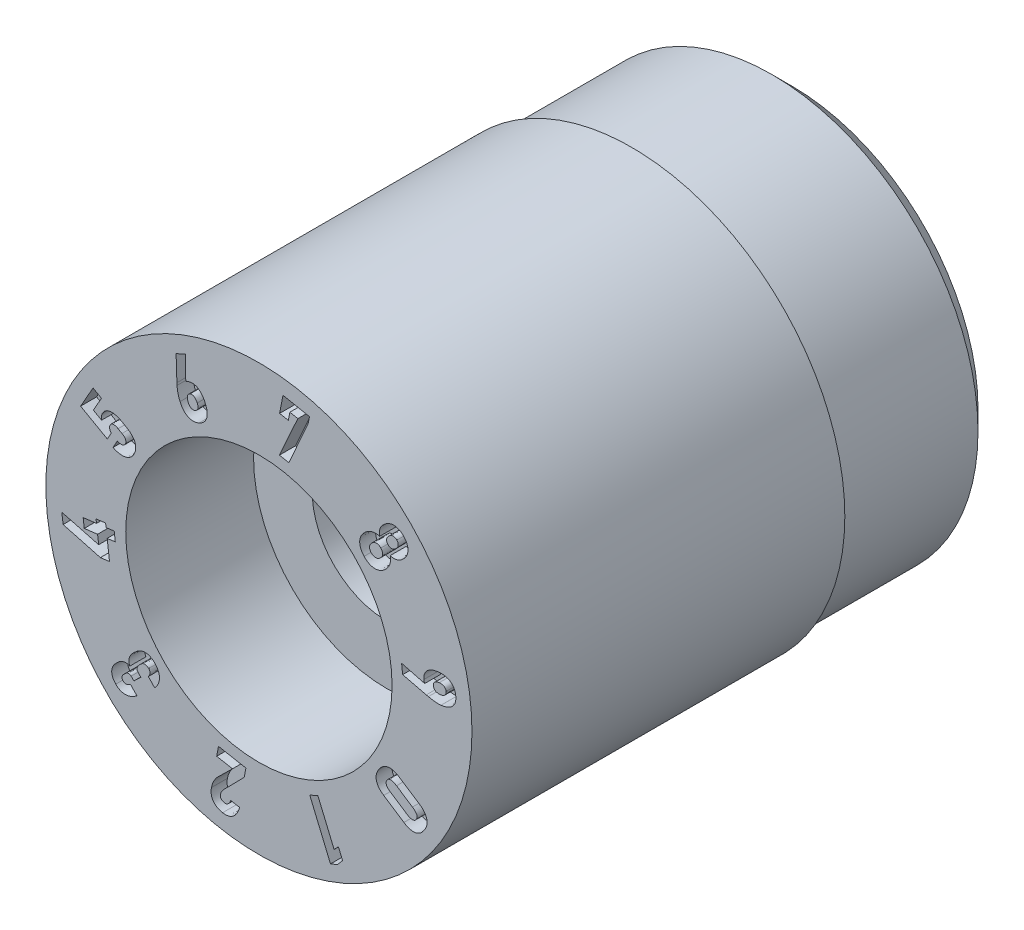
SolidWorks part; units mm, degrees
ref_plane "Front Plane" through (0, 0, 0) normal (0, 0, 1) x (1, 0, 0)
ref_plane "Top Plane" through (0, 0, 0) normal (0, 1, 0) x (1, 0, 0)
ref_plane "Right Plane" through (0, 0, 0) normal (1, 0, 0) x (0, 0, -1)
sketch "Sketch1" plane through (0, 0, 0) normal (1, 0, 0) x (0, 0, -1)
  line L2 (0, 2) -> (0, 1.25)
  line L3 (4.75, 2) -> (0, 2)
  line L4 (-3.7979, 0) -> (49996.2021, 0) construction
  line L8 (5, 0.7) -> (1.2, 0.7)
  line L9 (1.2, 1.25) -> (1.2, 0.7)
  line L10 (1.2, 1.25) -> (0, 1.25)
  line L12 (5, 0.7) -> (5, 1.75)
  line L16 (5, 1.75) -> (4.75, 2)
  dimension "D1" = 5
  dimension "D2" = 45
  dimension "D3" = 0.25
  dimension "D4" = 4
  dimension "D5" = 2.5
  dimension "D6" = 1.2
  dimension "D7" = 1.4
revolve "Revolve1" add sketch "Sketch1" angle 360 about L4
sketch "Sketch5" plane through (0, 0, 0) normal (1, 0, 0) x (0, 0, -1)
  line L0 (0, 0) -> (50000, 0) construction
  line L1 (0, 2) -> (0, -2) construction
  line L2 (3.5, 1.935) -> (5, 1.935)
  line L3 (3.5, 1.935) -> (3.5, 2.935)
  line L4 (3.5, 2.935) -> (5, 2.935)
  line L5 (5, 1.935) -> (5, 2.935)
  line L6 (5, -1.75) -> (5, 1.75) construction
  line L7 (4.75, 2) -> (0, 2) construction
  dimension "D1" = 3.5
  dimension "D2" = 0.065
  dimension "D3" = 1
revolve "Cut-Revolve1" cut sketch "Sketch5" angle 360 about L0
sketch "Sketch7" plane through (0, 0, 0) normal (0, 0, 1) x (1, 0, 0)
  line L0 (-1.5142, -0.1522) -> (-1.6396, -0.1678)
  line L1 (1.6806, 0.3271) -> (1.681, 0.3271)
  line L2 (1.7094, 0.0695) -> (1.7091, 0.0695)
  line L3 (1.5709, 0.0846) -> (1.3494, 0.1382)
  line L4 (1.3494, 0.1382) -> (1.3391, 0.2259)
  line L5 (1.3391, 0.2259) -> (1.5564, 0.1696)
  line L6 (1.7038, 0.1528) -> (1.7042, 0.1528)
  line L7 (1.693, 0.2446) -> (1.6927, 0.2446)
  line L8 (0.9938, 1.1161) -> (0.9999, 1.1218)
  line L9 (1.1661, 1.2638) -> (1.1757, 1.2727)
  line L10 (1.3542, 1.0805) -> (1.3446, 1.0717)
  line L11 (1.1909, 0.9164) -> (1.1848, 0.9107)
  line L12 (1.1381, 0.9811) -> (1.1417, 0.9844)
  line L13 (1.0639, 1.0675) -> (1.0601, 1.0639)
  line L14 (1.2851, 1.1303) -> (1.2886, 1.1334)
  line L15 (1.2234, 1.2031) -> (1.2196, 1.1997)
  line L16 (0.4628, 1.7375) -> (0.2818, 1.3271)
  line L17 (0.2818, 1.3271) -> (0.1928, 1.3444)
  line L18 (0.1928, 1.3444) -> (0.3656, 1.7276)
  line L19 (0.3656, 1.7276) -> (0.2907, 1.7422)
  line L20 (0.2907, 1.7422) -> (0.2763, 1.6682)
  line L21 (0.2763, 1.6682) -> (0.1943, 1.6842)
  line L22 (0.1943, 1.6842) -> (0.226, 1.8472)
  line L23 (0.226, 1.8472) -> (0.4747, 1.7988)
  line L24 (0.4747, 1.7988) -> (0.4628, 1.7375)
  line L25 (-0.7404, 1.3129) -> (-0.7405, 1.3132)
  line L26 (-0.7699, 1.4517) -> (-0.7771, 1.6843)
  line L27 (-0.7771, 1.6843) -> (-0.6913, 1.7235)
  line L28 (-0.6913, 1.7235) -> (-0.6862, 1.5014)
  line L29 (-1.4244, -0.141) -> (-1.4022, -0.3185)
  line L30 (-0.5054, 1.4223) -> (-0.5053, 1.422)
  line L31 (-0.5788, 1.382) -> (-0.579, 1.3823)
  line L32 (-0.6627, 1.3438) -> (-0.6626, 1.3435)
  line L33 (-1.369, 0.6256) -> (-1.3693, 0.6258)
  line L34 (-1.3693, 0.6258) -> (-1.3283, 0.6983)
  line L35 (-1.3283, 0.6983) -> (-1.328, 0.6981)
  line L36 (-1.2854, 0.781) -> (-1.3219, 0.8017)
  line L37 (-1.3852, 0.7353) -> (-1.4234, 0.6676)
  line L38 (-1.4234, 0.6676) -> (-1.6736, 0.8092)
  line L39 (-1.6736, 0.8092) -> (-1.5569, 1.0156)
  line L40 (-1.5569, 1.0156) -> (-1.4779, 0.971)
  line L41 (-1.4779, 0.971) -> (-1.5537, 0.837)
  line L42 (-1.5537, 0.837) -> (-1.4768, 0.7935)
  line L43 (-1.2809, 0.8742) -> (-1.2445, 0.8535)
  line L44 (-1.488, -0.3292) -> (-1.8381, -0.2352)
  line L45 (-1.8381, -0.2352) -> (-1.8498, -0.1414)
  line L46 (-1.8498, -0.1414) -> (-1.5042, -0.2323)
  line L47 (-1.5042, -0.2323) -> (-1.5142, -0.1522)
  line L48 (-1.5289, -0.0349) -> (-1.439, -0.0236)
  line L49 (-1.439, -0.0236) -> (-1.4347, -0.0581)
  line L50 (-1.4022, -0.3185) -> (-1.488, -0.3292)
  line L51 (-1.6396, -0.1678) -> (-1.6499, -0.0849)
  line L52 (-1.6499, -0.0849) -> (-1.5246, -0.0693)
  line L53 (-1.3583, -0.0486) -> (-1.348, -0.1316)
  line L54 (-1.348, -0.1316) -> (-1.4244, -0.141)
  line L55 (-0.9787, -1.1329) -> (-1.0379, -1.0708)
  line L56 (-1.1102, -1.0071) -> (-1.1187, -1.0151)
  line L57 (-1.1338, -1.0853) -> (-1.1081, -1.1123)
  line L58 (-1.1081, -1.1123) -> (-1.1737, -1.1748)
  line L59 (-1.1737, -1.1748) -> (-1.1994, -1.1478)
  line L60 (-1.2594, -1.1593) -> (-1.2656, -1.1652)
  line L61 (-1.2042, -1.2193) -> (-1.1451, -1.2813)
  line L62 (-1.3341, -1.1072) -> (-1.3232, -1.0968)
  line L63 (-1.1748, -0.9456) -> (-1.1639, -0.9352)
  line L64 (-0.1377, -1.44) -> (-0.3282, -1.6337)
  line L65 (-0.3606, -1.6897) -> (-0.3607, -1.6903)
  line L66 (-0.2657, -1.6911) -> (-0.2657, -1.6908)
  line L67 (-0.2657, -1.6908) -> (-0.1815, -1.7064)
  line L68 (-0.1815, -1.7064) -> (-0.1815, -1.7067)
  line L69 (-0.4456, -1.6773) -> (-0.4454, -1.6769)
  line L70 (-0.3829, -1.5584) -> (-0.2475, -1.4257)
  line L71 (-0.2475, -1.4257) -> (-0.3962, -1.3981)
  line L72 (-0.3962, -1.3981) -> (-0.3797, -1.309)
  line L73 (-0.3797, -1.309) -> (-0.1222, -1.3567)
  line L74 (-0.1222, -1.3567) -> (-0.1377, -1.44)
  line L75 (0.4773, -1.2764) -> (0.5541, -1.2441)
  line L76 (0.5541, -1.2441) -> (0.7056, -1.6046)
  line L77 (0.7056, -1.6046) -> (0.7462, -1.5625)
  line L78 (0.7462, -1.5625) -> (0.7851, -1.6552)
  line L79 (0.7851, -1.6552) -> (0.7375, -1.7119)
  line L80 (0.7375, -1.7119) -> (0.6719, -1.7395)
  line L81 (0.6719, -1.7395) -> (0.4773, -1.2764)
  line L82 (1.3177, -0.7109) -> (1.5071, -0.8358)
  line L83 (1.361, -1.0574) -> (1.1716, -0.9326)
  line L84 (1.2376, -0.876) -> (1.387, -0.9744)
  line L85 (1.4411, -0.8924) -> (1.2917, -0.794)
  line L86 (-1.4347, -0.0581) -> (-1.3583, -0.0486)
  line L87 (-1.5246, -0.0693) -> (-1.5289, -0.0349)
  spline S0 degree 3 poles (1.5564, 0.1696) (1.5563, 0.17) (1.5548, 0.1731) (1.5513, 0.1824) (1.5491, 0.1918) (1.5485, 0.1984) knots 0.575687 0.575687 0.575687 0.575687 0.592674 0.720868 1 1 1 1
  spline S1 degree 3 poles (1.5485, 0.1984) (1.5473, 0.2089) (1.5476, 0.2249) (1.553, 0.2451) (1.5594, 0.2593) (1.568, 0.2725) (1.5788, 0.2844) (1.5915, 0.2951) (1.6062, 0.3046) (1.6226, 0.3127) (1.6472, 0.3216) (1.667, 0.3254) (1.6806, 0.3271) knots 0 0 0 0 0.154342 0.228386 0.302989 0.3789 0.455726 0.53585 0.619968 0.708622 0.800971 1 1 1 1
  spline S2 degree 3 poles (1.681, 0.3271) (1.6958, 0.3289) (1.7177, 0.3299) (1.7458, 0.3267) (1.7646, 0.322) (1.7817, 0.3156) (1.7971, 0.3071) (1.8106, 0.2964) (1.8222, 0.2839) (1.8318, 0.2695) (1.842, 0.2472) (1.8463, 0.2288) (1.8477, 0.216) knots 0 0 0 0 0.197916 0.287724 0.372159 0.45229 0.528708 0.60302 0.677527 0.753081 0.830657 1 1 1 1
  spline S3 degree 3 poles (1.8477, 0.216) (1.8493, 0.2034) (1.8493, 0.1846) (1.8444, 0.1606) (1.8382, 0.1444) (1.8297, 0.1295) (1.8188, 0.116) (1.8056, 0.1042) (1.7903, 0.0938) (1.7729, 0.0851) (1.7461, 0.0754) (1.7244, 0.0712) (1.7094, 0.0695) knots 0 0 0 0 0.167209 0.244725 0.320117 0.394646 0.46919 0.546248 0.626545 0.711531 0.801283 1 1 1 1
  spline S4 degree 3 poles (1.7091, 0.0695) (1.7005, 0.0684) (1.6871, 0.0679) (1.6689, 0.0682) (1.6544, 0.0694) (1.6393, 0.0712) (1.6179, 0.0744) (1.6015, 0.0777) (1.5904, 0.08) knots 0 0 0 0 0.217526 0.334184 0.455433 0.582256 0.714812 1 1 1 1
  spline S5 degree 3 poles (1.5904, 0.08) (1.5871, 0.0807) (1.5805, 0.082) (1.5741, 0.0838) (1.5709, 0.0846) knots 0 0 0 0 0.505693 1 1 1 1
  spline S6 degree 3 poles (1.6377, 0.1914) (1.6386, 0.1849) (1.6413, 0.1751) (1.6497, 0.1651) (1.6575, 0.1591) (1.6671, 0.155) (1.6826, 0.1514) (1.6952, 0.1519) (1.7038, 0.1528) knots 0 0 0 0 0.230169 0.338418 0.449646 0.568574 0.698316 1 1 1 1
  spline S7 degree 3 poles (1.7042, 0.1528) (1.7125, 0.1538) (1.7243, 0.1565) (1.7381, 0.1633) (1.746, 0.1696) (1.7521, 0.177) (1.7573, 0.1889) (1.758, 0.1989) (1.7571, 0.2054) knots 0 0 0 0 0.298042 0.425532 0.543246 0.654924 0.764691 1 1 1 1
  spline S8 degree 3 poles (1.7571, 0.2054) (1.7563, 0.2121) (1.7536, 0.2219) (1.7455, 0.2322) (1.7377, 0.238) (1.7285, 0.2423) (1.7135, 0.2458) (1.7013, 0.2456) (1.693, 0.2446) knots 0 0 0 0 0.237917 0.346299 0.458254 0.576208 0.703244 1 1 1 1
  spline S9 degree 3 poles (1.6927, 0.2446) (1.6841, 0.2435) (1.6718, 0.241) (1.6576, 0.234) (1.6494, 0.2276) (1.6431, 0.2201) (1.6374, 0.2082) (1.6371, 0.198) (1.6377, 0.1914) knots 0 0 0 0 0.301058 0.429121 0.547462 0.658814 0.765817 1 1 1 1
  spline S10 degree 3 poles (0.9877, 0.919) (0.9788, 0.9288) (0.9667, 0.9442) (0.9555, 0.9673) (0.9496, 0.9845) (0.9463, 1.002) (0.9458, 1.0195) (0.9474, 1.0369) (0.9519, 1.054) (0.9588, 1.0707) (0.9713, 1.0927) (0.9843, 1.1072) (0.9938, 1.1161) knots 0 0 0 0 0.178865 0.262561 0.344368 0.424163 0.502187 0.579638 0.65918 0.740439 0.823444 1 1 1 1
  spline S11 degree 3 poles (0.9999, 1.1218) (1.0089, 1.1302) (1.0238, 1.141) (1.0462, 1.1511) (1.0637, 1.1567) (1.0817, 1.16) (1.1052, 1.1611) (1.1226, 1.1583) (1.1335, 1.1546) knots 0 0 0 0 0.2551 0.381157 0.510317 0.637625 0.760202 1 1 1 1
  spline S12 degree 3 poles (1.1335, 1.1546) (1.1311, 1.1641) (1.1294, 1.1789) (1.1314, 1.1986) (1.1347, 1.2134) (1.14, 1.2277) (1.1492, 1.2455) (1.1588, 1.2571) (1.1661, 1.2638) knots 0 0 0 0 0.246185 0.369649 0.497384 0.625631 0.75083 1 1 1 1
  spline S13 degree 3 poles (1.1757, 1.2727) (1.1848, 1.281) (1.1992, 1.2922) (1.2208, 1.3025) (1.2369, 1.3079) (1.2534, 1.3109) (1.2698, 1.3115) (1.2862, 1.3098) (1.3024, 1.3055) (1.3182, 1.2991) (1.339, 1.2872) (1.3526, 1.2749) (1.361, 1.2659) knots 0 0 0 0 0.177128 0.2605 0.341667 0.421494 0.499624 0.577652 0.657305 0.738948 0.822231 1 1 1 1
  spline S14 degree 3 poles (1.361, 1.2659) (1.3694, 1.2568) (1.3806, 1.2423) (1.391, 1.2207) (1.3963, 1.2045) (1.3993, 1.188) (1.4, 1.1716) (1.3981, 1.1552) (1.3939, 1.139) (1.3875, 1.1232) (1.3753, 1.1027) (1.3634, 1.0889) (1.3542, 1.0805) knots 0 0 0 0 0.177766 0.261115 0.342723 0.422528 0.500149 0.578694 0.658324 0.739494 0.822575 1 1 1 1
  spline S15 degree 3 poles (1.3446, 1.0717) (1.3373, 1.0649) (1.3249, 1.056) (1.3063, 1.0481) (1.2916, 1.0441) (1.2766, 1.0419) (1.2567, 1.0418) (1.242, 1.0446) (1.2328, 1.0478) knots 0 0 0 0 0.25101 0.37578 0.503509 0.630444 0.754426 1 1 1 1
  spline S16 degree 3 poles (1.2328, 1.0478) (1.2355, 1.0365) (1.2373, 1.0189) (1.2345, 0.9953) (1.23, 0.9776) (1.2234, 0.9604) (1.2117, 0.9389) (1.1999, 0.9246) (1.1909, 0.9164) knots 0 0 0 0 0.241695 0.364575 0.491897 0.62057 0.745921 1 1 1 1
  spline S17 degree 3 poles (1.1848, 0.9107) (1.1752, 0.9017) (1.1597, 0.8901) (1.137, 0.879) (1.1198, 0.8733) (1.1023, 0.8702) (1.0848, 0.8697) (1.0674, 0.8716) (1.0502, 0.8763) (1.0334, 0.8834) (1.0114, 0.8963) (0.9967, 0.9094) (0.9877, 0.919) knots 0 0 0 0 0.176635 0.259674 0.340714 0.420304 0.497814 0.576233 0.655966 0.737533 0.820955 1 1 1 1
  spline S18 degree 3 poles (1.0541, 0.9808) (1.0577, 0.9769) (1.0637, 0.9718) (1.0728, 0.9668) (1.0798, 0.9641) (1.0871, 0.9626) (1.0946, 0.9621) (1.1021, 0.9626) (1.1097, 0.9642) (1.1172, 0.9669) (1.1272, 0.9719) (1.1338, 0.9772) (1.1381, 0.9811) knots 0 0 0 0 0.168215 0.248473 0.328119 0.406502 0.485537 0.564573 0.646351 0.730053 0.817003 1 1 1 1
  spline S19 degree 3 poles (1.1417, 0.9844) (1.1455, 0.9881) (1.1508, 0.9939) (1.1558, 1.0028) (1.1585, 1.0096) (1.1603, 1.0166) (1.161, 1.0237) (1.1607, 1.0308) (1.1594, 1.0379) (1.1572, 1.0449) (1.1526, 1.0542) (1.1479, 1.0605) (1.1442, 1.0644) knots 0 0 0 0 0.176883 0.260022 0.340338 0.419699 0.498223 0.57642 0.655715 0.737714 0.82076 1 1 1 1
  spline S20 degree 3 poles (1.1442, 1.0644) (1.1405, 1.0683) (1.1347, 1.0737) (1.1257, 1.0787) (1.1188, 1.0815) (1.1119, 1.0834) (1.1048, 1.084) (1.0976, 1.0839) (1.0904, 1.0825) (1.0834, 1.0803) (1.0741, 1.0759) (1.0679, 1.071) (1.0639, 1.0675) knots 0 0 0 0 0.177833 0.260675 0.34217 0.421528 0.499771 0.578775 0.659098 0.740803 0.823067 1 1 1 1
  spline S21 degree 3 poles (1.0601, 1.0639) (1.0558, 1.0601) (1.0503, 1.0537) (1.0445, 1.0442) (1.0414, 1.037) (1.0392, 1.0296) (1.0382, 1.0222) (1.0381, 1.0148) (1.0393, 1.0075) (1.0414, 1.0003) (1.046, 0.9911) (1.0503, 0.9845) (1.0541, 0.9808) knots 0 0 0 0 0.183567 0.269825 0.353983 0.435456 0.514421 0.591549 0.670671 0.75006 0.830718 1 1 1 1
  spline S22 degree 3 poles (1.2111, 1.1266) (1.2142, 1.1233) (1.2193, 1.1189) (1.2272, 1.1148) (1.2332, 1.1128) (1.2396, 1.1116) (1.2461, 1.1116) (1.2527, 1.1124) (1.2594, 1.1142) (1.2661, 1.1168) (1.2751, 1.1218) (1.2812, 1.1266) (1.2851, 1.1303) knots 0 0 0 0 0.163469 0.240494 0.316585 0.393494 0.470452 0.550442 0.632503 0.719145 0.80824 1 1 1 1
  spline S23 degree 3 poles (1.2886, 1.1334) (1.2923, 1.1368) (1.2971, 1.1422) (1.3022, 1.1503) (1.3049, 1.1564) (1.3069, 1.1626) (1.3078, 1.1689) (1.3079, 1.1752) (1.3071, 1.1814) (1.3054, 1.1875) (1.3016, 1.1955) (1.2978, 1.201) (1.2946, 1.2042) knots 0 0 0 0 0.187062 0.272248 0.356042 0.43741 0.515938 0.592362 0.670714 0.750135 0.829923 1 1 1 1
  spline S24 degree 3 poles (1.2946, 1.2042) (1.2915, 1.2076) (1.2865, 1.212) (1.2787, 1.2161) (1.2727, 1.2182) (1.2666, 1.2196) (1.2604, 1.2198) (1.254, 1.2194) (1.2477, 1.2178) (1.2413, 1.2155) (1.2328, 1.211) (1.227, 1.2065) (1.2234, 1.2031) knots 0 0 0 0 0.169927 0.248952 0.327351 0.405378 0.483001 0.560789 0.643098 0.727145 0.814694 1 1 1 1
  spline S25 degree 3 poles (1.2196, 1.1997) (1.2158, 1.1961) (1.2106, 1.1904) (1.2052, 1.182) (1.2021, 1.1755) (1.2, 1.169) (1.1985, 1.1625) (1.1983, 1.1561) (1.1989, 1.1497) (1.2005, 1.1435) (1.204, 1.1353) (1.208, 1.1299) (1.2111, 1.1266) knots 0 0 0 0 0.188717 0.277937 0.363923 0.446926 0.526196 0.603917 0.680676 0.758388 0.836217 1 1 1 1
  spline S26 degree 3 poles (-0.5602, 1.2295) (-0.5718, 1.2242) (-0.5896, 1.2183) (-0.6138, 1.2155) (-0.6311, 1.2162) (-0.6478, 1.2194) (-0.6637, 1.2255) (-0.6789, 1.234) (-0.6933, 1.245) (-0.7068, 1.2585) (-0.7238, 1.2806) (-0.7342, 1.2995) (-0.7404, 1.3129) knots 0 0 0 0 0.169425 0.247701 0.32376 0.398456 0.473317 0.549457 0.629523 0.713965 0.802912 1 1 1 1
  spline S27 degree 3 poles (-0.7405, 1.3132) (-0.7443, 1.3217) (-0.7496, 1.3349) (-0.7551, 1.3533) (-0.7632, 1.3832) (-0.7666, 1.4091) (-0.7686, 1.43) knots 0 0 0 0 0.231657 0.352644 0.477573 1 1 1 1
  spline S28 degree 3 poles (-0.7686, 1.43) (-0.7689, 1.4336) (-0.7697, 1.4409) (-0.7697, 1.4481) (-0.7699, 1.4517) knots 0 0 0 0 0.503063 1 1 1 1
  spline S29 degree 3 poles (-0.6862, 1.5014) (-0.6819, 1.5047) (-0.6772, 1.5075) (-0.6722, 1.5098) knots 0.764686 0.764686 0.764686 0.764686 1 1 1 1
  spline S30 degree 3 poles (-0.6722, 1.5098) (-0.6619, 1.5146) (-0.6457, 1.5197) (-0.6238, 1.5215) (-0.6081, 1.5201) (-0.5928, 1.5163) (-0.5781, 1.51) (-0.564, 1.5011) (-0.5507, 1.4897) (-0.5378, 1.4762) (-0.5216, 1.4542) (-0.5114, 1.4356) (-0.5054, 1.4223) knots 0 0 0 0 0.160459 0.235287 0.308247 0.381672 0.456025 0.533385 0.615195 0.702139 0.794729 1 1 1 1
  spline S31 degree 3 poles (-0.5053, 1.422) (-0.4992, 1.4084) (-0.4914, 1.388) (-0.4861, 1.3603) (-0.4846, 1.3411) (-0.4856, 1.3228) (-0.489, 1.3056) (-0.495, 1.2895) (-0.5034, 1.2746) (-0.5142, 1.2611) (-0.5323, 1.2444) (-0.5486, 1.2348) (-0.5602, 1.2295) knots 0 0 0 0 0.197488 0.28655 0.371144 0.451142 0.527616 0.602299 0.677047 0.752733 0.830523 1 1 1 1
  spline S32 degree 3 poles (-0.5978, 1.3119) (-0.5917, 1.3147) (-0.5834, 1.3202) (-0.5756, 1.3307) (-0.5723, 1.3395) (-0.5707, 1.3491) (-0.5716, 1.3638) (-0.5755, 1.3748) (-0.5788, 1.382) knots 0 0 0 0 0.244452 0.355993 0.467582 0.584057 0.709091 1 1 1 1
  spline S33 degree 3 poles (-0.579, 1.3823) (-0.5827, 1.3907) (-0.5892, 1.4021) (-0.6005, 1.4144) (-0.6092, 1.4207) (-0.6185, 1.4248) (-0.6317, 1.4268) (-0.6417, 1.4244) (-0.6477, 1.4215) knots 0 0 0 0 0.307386 0.437241 0.55652 0.66685 0.772945 1 1 1 1
  spline S34 degree 3 poles (-0.6477, 1.4215) (-0.6538, 1.4188) (-0.6622, 1.413) (-0.6689, 1.4015) (-0.6719, 1.3918) (-0.6728, 1.381) (-0.6708, 1.3645) (-0.6665, 1.3521) (-0.6627, 1.3438) knots 0 0 0 0 0.223938 0.330652 0.44208 0.562623 0.69374 1 1 1 1
  spline S35 degree 3 poles (-0.6626, 1.3435) (-0.6593, 1.3363) (-0.6536, 1.3262) (-0.6431, 1.316) (-0.6349, 1.3107) (-0.6261, 1.3077) (-0.6133, 1.3066) (-0.6038, 1.3091) (-0.5978, 1.3119) knots 0 0 0 0 0.292476 0.418585 0.535162 0.647147 0.757326 1 1 1 1
  spline S36 degree 3 poles (-1.1751, 0.6646) (-1.1807, 0.6547) (-1.1908, 0.641) (-1.2079, 0.6264) (-1.2219, 0.6173) (-1.2372, 0.6105) (-1.2536, 0.6057) (-1.2711, 0.6034) (-1.2896, 0.603) (-1.3088, 0.6051) (-1.3359, 0.6113) (-1.3559, 0.6192) (-1.369, 0.6256) knots 0 0 0 0 0.154778 0.229982 0.305397 0.381063 0.45817 0.537687 0.62153 0.709094 0.800675 1 1 1 1
  spline S37 degree 3 poles (-1.328, 0.6981) (-1.3204, 0.6947) (-1.309, 0.6906) (-1.2937, 0.6889) (-1.2835, 0.6896) (-1.2742, 0.6921) (-1.2632, 0.698) (-1.2571, 0.7053) (-1.254, 0.7107) knots 0 0 0 0 0.300685 0.431189 0.552727 0.667114 0.7756 1 1 1 1
  spline S38 degree 3 poles (-1.254, 0.7107) (-1.2508, 0.7165) (-1.2473, 0.726) (-1.2483, 0.739) (-1.2512, 0.7484) (-1.2566, 0.7574) (-1.2671, 0.7696) (-1.2778, 0.7766) (-1.2854, 0.781) knots 0 0 0 0 0.229073 0.335997 0.446506 0.565755 0.695468 1 1 1 1
  spline S39 degree 3 poles (-1.3219, 0.8017) (-1.3295, 0.8061) (-1.3409, 0.8114) (-1.3565, 0.8149) (-1.3666, 0.8151) (-1.3758, 0.8135) (-1.3867, 0.8083) (-1.3929, 0.8016) (-1.3957, 0.7963) knots 0 0 0 0 0.31782 0.450521 0.571898 0.681761 0.784843 1 1 1 1
  spline S40 degree 3 poles (-1.3957, 0.7963) (-1.3984, 0.7914) (-1.4016, 0.7836) (-1.4025, 0.7727) (-1.4019, 0.7646) (-1.3999, 0.7567) (-1.395, 0.7463) (-1.3894, 0.7395) (-1.3852, 0.7353) knots 0 0 0 0 0.250775 0.369742 0.488582 0.609434 0.733145 1 1 1 1
  spline S41 degree 3 poles (-1.4768, 0.7935) (-1.4783, 0.798) (-1.4795, 0.8054) (-1.4795, 0.8156) (-1.4785, 0.8238) (-1.4768, 0.8321) (-1.4737, 0.8427) (-1.4705, 0.8503) (-1.4677, 0.8549) knots 0 0 0 0 0.226423 0.347979 0.479919 0.615426 0.745491 1 1 1 1
  spline S42 degree 3 poles (-1.4677, 0.8549) (-1.4626, 0.8643) (-1.4529, 0.877) (-1.4367, 0.8902) (-1.4234, 0.8976) (-1.4089, 0.9028) (-1.3932, 0.9054) (-1.3765, 0.9059) (-1.3589, 0.9041) (-1.3404, 0.8999) (-1.3137, 0.8913) (-1.2941, 0.8815) (-1.2809, 0.8742) knots 0 0 0 0 0.152166 0.223347 0.294447 0.366447 0.440747 0.518751 0.601934 0.691147 0.786728 1 1 1 1
  spline S43 degree 3 poles (-1.2445, 0.8535) (-1.2314, 0.846) (-1.213, 0.8339) (-1.1923, 0.8146) (-1.1797, 0.7998) (-1.1697, 0.7843) (-1.1624, 0.7683) (-1.1576, 0.7518) (-1.1557, 0.7347) (-1.1564, 0.7173) (-1.1611, 0.6932) (-1.1688, 0.6758) (-1.1751, 0.6646) knots 0 0 0 0 0.198061 0.287434 0.372024 0.452139 0.52865 0.602966 0.677551 0.753056 0.830797 1 1 1 1
  spline S44 degree 3 poles (-0.975, -0.9341) (-0.9664, -0.9434) (-0.9546, -0.9582) (-0.9434, -0.9802) (-0.9375, -0.997) (-0.9339, -1.0141) (-0.9325, -1.0315) (-0.9341, -1.049) (-0.9379, -1.0666) (-0.9443, -1.084) (-0.9565, -1.1072) (-0.9691, -1.1231) (-0.9787, -1.1329) knots 0 0 0 0 0.17138 0.25246 0.3321 0.410218 0.487785 0.565878 0.646425 0.72927 0.815073 1 1 1 1
  spline S45 degree 3 poles (-1.0379, -1.0708) (-1.0319, -1.0638) (-1.0261, -1.0537) (-1.0229, -1.0409) (-1.0223, -1.035) (-1.0225, -1.0293) (-1.0234, -1.0238) (-1.025, -1.0184) (-1.0284, -1.0113) (-1.0321, -1.0066) (-1.0348, -1.0037) knots 0 0 0 0 0.373227 0.455142 0.533831 0.610763 0.685923 0.760617 0.838001 1 1 1 1
  spline S46 degree 3 poles (-1.0348, -1.0037) (-1.0397, -0.9986) (-1.048, -0.9918) (-1.0612, -0.9879) (-1.071, -0.9871) (-1.081, -0.9887) (-1.095, -0.9943) (-1.1044, -1.0014) (-1.1102, -1.0071) knots 0 0 0 0 0.249604 0.362893 0.476239 0.59303 0.71545 1 1 1 1
  spline S47 degree 3 poles (-1.1187, -1.0151) (-1.1246, -1.0211) (-1.1331, -1.0299) (-1.1404, -1.0434) (-1.1437, -1.0527) (-1.1445, -1.0617) (-1.1427, -1.0734) (-1.1378, -1.0811) (-1.1338, -1.0853) knots 0 0 0 0 0.313959 0.446944 0.566427 0.676462 0.781028 1 1 1 1
  spline S48 degree 3 poles (-1.1994, -1.1478) (-1.2027, -1.1443) (-1.2089, -1.14) (-1.2187, -1.1385) (-1.2263, -1.1392) (-1.2344, -1.1416) (-1.2461, -1.1477) (-1.2542, -1.1543) (-1.2594, -1.1593) knots 0 0 0 0 0.212471 0.314901 0.42678 0.547702 0.682699 1 1 1 1
  spline S49 degree 3 poles (-1.2656, -1.1652) (-1.2706, -1.1699) (-1.2771, -1.1773) (-1.2827, -1.1885) (-1.2849, -1.1964) (-1.2853, -1.2041) (-1.2833, -1.2143) (-1.2789, -1.221) (-1.2752, -1.2247) knots 0 0 0 0 0.300296 0.428754 0.548156 0.660448 0.767243 1 1 1 1
  spline S50 degree 3 poles (-1.2752, -1.2247) (-1.2727, -1.2273) (-1.2684, -1.2307) (-1.2617, -1.2337) (-1.2564, -1.2353) (-1.2507, -1.236) (-1.2446, -1.2358) (-1.2384, -1.235) (-1.2318, -1.2335) (-1.2251, -1.2311) (-1.2156, -1.2267) (-1.2087, -1.2225) (-1.2042, -1.2193) knots 0 0 0 0 0.139542 0.208718 0.279622 0.353559 0.430867 0.511468 0.597587 0.689155 0.787063 1 1 1 1
  spline S51 degree 3 poles (-1.1451, -1.2813) (-1.1562, -1.2903) (-1.1737, -1.3024) (-1.1986, -1.314) (-1.2167, -1.3202) (-1.2348, -1.3238) (-1.2524, -1.3254) (-1.2696, -1.3244) (-1.2862, -1.321) (-1.302, -1.3153) (-1.3223, -1.3048) (-1.3355, -1.2938) (-1.3435, -1.2854) knots 0 0 0 0 0.195991 0.286892 0.373831 0.456977 0.536848 0.61428 0.690799 0.766921 0.843102 1 1 1 1
  spline S52 degree 3 poles (-1.3435, -1.2854) (-1.3497, -1.2787) (-1.3585, -1.2683) (-1.3678, -1.2533) (-1.3733, -1.2422) (-1.3774, -1.231) (-1.3802, -1.2196) (-1.3816, -1.2081) (-1.3817, -1.1966) (-1.3805, -1.185) (-1.3778, -1.1735) (-1.3739, -1.162) (-1.3685, -1.1508) (-1.362, -1.1396) (-1.351, -1.1246) (-1.3412, -1.114) (-1.3341, -1.1072) knots 0 0 0 0 0.136697 0.199785 0.260155 0.318892 0.376218 0.432859 0.489566 0.546591 0.604778 0.663653 0.72471 0.78814 0.854993 1 1 1 1
  spline S53 degree 3 poles (-1.3232, -1.0968) (-1.3153, -1.0893) (-1.3024, -1.0795) (-1.2834, -1.0704) (-1.2689, -1.066) (-1.2542, -1.0638) (-1.2343, -1.0641) (-1.2198, -1.068) (-1.2106, -1.0718) knots 0 0 0 0 0.267556 0.392658 0.515349 0.636469 0.755501 1 1 1 1
  spline S54 degree 3 poles (-1.2106, -1.0718) (-1.2134, -1.0672) (-1.2163, -1.0598) (-1.2192, -1.0497) (-1.2204, -1.042) (-1.221, -1.0342) (-1.2205, -1.0262) (-1.2194, -1.0182) (-1.2167, -1.0071) (-1.2114, -0.9932) (-1.1983, -0.9706) (-1.1851, -0.9551) (-1.1748, -0.9456) knots 0 0 0 0 0.113125 0.167511 0.222087 0.27753 0.332932 0.390244 0.449326 0.573035 0.704315 1 1 1 1
  spline S55 degree 3 poles (-1.1639, -0.9352) (-1.154, -0.926) (-1.1388, -0.9133) (-1.1163, -0.9011) (-1.1, -0.8946) (-1.0836, -0.8906) (-1.0672, -0.8893) (-1.0509, -0.8904) (-1.0349, -0.8942) (-1.0191, -0.9006) (-0.9978, -0.9124) (-0.9839, -0.925) (-0.975, -0.9341) knots 0 0 0 0 0.189438 0.274812 0.356422 0.434469 0.510182 0.584876 0.661428 0.74004 0.821632 1 1 1 1
  spline S56 degree 3 poles (-0.3282, -1.6337) (-0.3364, -1.642) (-0.3501, -1.6593) (-0.3586, -1.6797) (-0.3606, -1.6897) knots 0 0 0 0 0.535832 1 1 1 1
  spline S57 degree 3 poles (-0.3607, -1.6903) (-0.3618, -1.6962) (-0.3623, -1.7053) (-0.3591, -1.7163) (-0.3552, -1.7234) (-0.3495, -1.7293) (-0.3398, -1.7362) (-0.3307, -1.7385) (-0.3246, -1.7399) knots 0 0 0 0 0.262585 0.378171 0.491972 0.606678 0.72624 1 1 1 1
  spline S58 degree 3 poles (-0.3246, -1.7399) (-0.3183, -1.741) (-0.3085, -1.7412) (-0.2966, -1.7366) (-0.2886, -1.7311) (-0.2812, -1.7238) (-0.2725, -1.7108) (-0.268, -1.6993) (-0.2657, -1.6911) knots 0 0 0 0 0.226995 0.33496 0.447555 0.568155 0.69942 1 1 1 1
  spline S59 degree 3 poles (-0.1815, -1.7067) (-0.1852, -1.7209) (-0.1918, -1.7413) (-0.2046, -1.7661) (-0.2154, -1.782) (-0.2274, -1.7961) (-0.2408, -1.8076) (-0.2552, -1.8173) (-0.2707, -1.8244) (-0.2872, -1.8293) (-0.3106, -1.8326) (-0.3286, -1.8314) (-0.3405, -1.8291) knots 0 0 0 0 0.19634 0.286034 0.372175 0.454052 0.532377 0.608806 0.684902 0.760733 0.837453 1 1 1 1
  spline S60 degree 3 poles (-0.3405, -1.8291) (-0.3532, -1.8268) (-0.3713, -1.8216) (-0.3933, -1.811) (-0.4074, -1.8016) (-0.4195, -1.7906) (-0.4297, -1.7783) (-0.4377, -1.7644) (-0.4437, -1.7492) (-0.4474, -1.7328) (-0.4498, -1.7086) (-0.4478, -1.6899) (-0.4456, -1.6773) knots 0 0 0 0 0.183992 0.268295 0.348467 0.425852 0.501121 0.576446 0.653671 0.733454 0.816938 1 1 1 1
  spline S61 degree 3 poles (-0.4454, -1.6769) (-0.4434, -1.6658) (-0.439, -1.6493) (-0.4305, -1.628) (-0.423, -1.6124) (-0.4144, -1.5975) (-0.4017, -1.5789) (-0.3908, -1.5661) (-0.3829, -1.5584) knots 0 0 0 0 0.249882 0.376348 0.503682 0.630902 0.756001 1 1 1 1
  spline S62 degree 3 poles (1.1263, -0.7437) (1.1319, -0.7352) (1.141, -0.7232) (1.1549, -0.7096) (1.1654, -0.7011) (1.1764, -0.6939) (1.1879, -0.6884) (1.1998, -0.6843) (1.2121, -0.6816) (1.2248, -0.6804) (1.2376, -0.6807) (1.2507, -0.6822) (1.2638, -0.6852) (1.2771, -0.6895) (1.2956, -0.6974) (1.3089, -0.7051) (1.3177, -0.7109) knots 0 0 0 0 0.139031 0.2029 0.263857 0.322527 0.379824 0.436367 0.493399 0.550807 0.608416 0.667347 0.728275 0.79123 0.857306 1 1 1 1
  spline S63 degree 3 poles (1.5071, -0.8358) (1.5159, -0.8417) (1.5285, -0.8509) (1.5431, -0.8649) (1.5524, -0.8755) (1.5605, -0.8864) (1.567, -0.8978) (1.5721, -0.9096) (1.5759, -0.9217) (1.5783, -0.934) (1.5791, -0.9466) (1.5786, -0.9593) (1.5762, -0.9721) (1.5725, -0.9851) (1.5655, -1.0032) (1.5579, -1.0161) (1.5524, -1.0247) knots 0 0 0 0 0.144011 0.210441 0.274069 0.335036 0.39403 0.451768 0.508708 0.565417 0.621711 0.678871 0.73731 0.798532 0.861804 1 1 1 1
  spline S64 degree 3 poles (1.5524, -1.0247) (1.5467, -1.0332) (1.5377, -1.0451) (1.524, -1.0588) (1.5135, -1.0674) (1.5026, -1.0745) (1.4912, -1.0802) (1.4793, -1.0843) (1.4671, -1.0871) (1.4546, -1.0882) (1.4418, -1.0882) (1.4288, -1.0865) (1.4156, -1.0835) (1.4022, -1.0791) (1.3835, -1.0711) (1.3699, -1.0633) (1.361, -1.0574) knots 0 0 0 0 0.138584 0.202056 0.26259 0.321448 0.378472 0.434519 0.491138 0.548026 0.605108 0.664031 0.724894 0.788361 0.855392 1 1 1 1
  spline S65 degree 3 poles (1.1716, -0.9326) (1.1628, -0.9266) (1.1502, -0.9174) (1.1356, -0.9034) (1.1263, -0.8928) (1.1184, -0.8818) (1.1119, -0.8705) (1.1066, -0.8588) (1.1028, -0.8467) (1.1004, -0.8344) (1.0996, -0.8218) (1.1002, -0.8091) (1.1026, -0.7963) (1.1061, -0.7832) (1.1134, -0.7653) (1.1206, -0.7522) (1.1263, -0.7437) knots 0 0 0 0 0.144106 0.210579 0.274249 0.334986 0.394019 0.451559 0.508536 0.565283 0.621614 0.678812 0.737743 0.798437 0.86192 1 1 1 1
  spline S66 degree 3 poles (1.2019, -0.7936) (1.1975, -0.7998) (1.1934, -0.8104) (1.1937, -0.8252) (1.1974, -0.8358) (1.2037, -0.8463) (1.2164, -0.8608) (1.2287, -0.87) (1.2376, -0.876) knots 0 0 0 0 0.222584 0.324871 0.432331 0.550088 0.682295 1 1 1 1
  spline S67 degree 3 poles (1.387, -0.9744) (1.3959, -0.9805) (1.4094, -0.9878) (1.4277, -0.9939) (1.438, -0.9954) (1.4456, -0.9951) (1.451, -0.9943) (1.456, -0.9928) (1.4608, -0.9905) (1.4653, -0.9877) (1.471, -0.9827) (1.4746, -0.9781) (1.4768, -0.9748) knots 0 0 0 0 0.317449 0.449917 0.567123 0.622273 0.674993 0.726343 0.777438 0.829699 0.883717 1 1 1 1
  spline S68 degree 3 poles (1.4768, -0.9748) (1.4809, -0.9686) (1.4855, -0.958) (1.4849, -0.9431) (1.4813, -0.9325) (1.4749, -0.9222) (1.4624, -0.9076) (1.45, -0.8984) (1.4411, -0.8924) knots 0 0 0 0 0.223805 0.326172 0.432727 0.550537 0.682152 1 1 1 1
  spline S69 degree 3 poles (1.2917, -0.794) (1.2828, -0.788) (1.2694, -0.7804) (1.251, -0.7744) (1.2407, -0.7731) (1.2331, -0.7732) (1.2278, -0.774) (1.2227, -0.7755) (1.218, -0.7778) (1.2135, -0.7807) (1.2077, -0.7856) (1.2041, -0.7903) (1.2019, -0.7936) knots 0 0 0 0 0.317398 0.449371 0.567395 0.621435 0.674077 0.725351 0.77637 0.828553 0.882491 1 1 1 1
extrude "Cut-Extrude1" cut sketch "Sketch7" against normal blind 0.15 contours L24 L23 L22 L21 L20 L19 L18 L17 L16 | S31 L30 S30 S29 L28 L27 L26 S28 S27 L25 S26 S35 L32 S34 S33 L31 S32 | S43 L43 S42 S41 L42 L41 L40 L39 L38 L37 S40 S39 L36 S38 S37 L35 L34 L33 S36 | L87 L52 L51 L0 L47 L46 L45 L44 L50 L29 L54 L53 L86 L49 L48 | S55 L63 S54 S53 L62 S52 S51 L61 S50 S49 L60 S48 L59 L58 L57 S47 L56 S46 S45 L55 S44 | L81 L80 L79 L78 L77 L76 L75 | S61 L69 S60 S59 L68 L67 L66 S58 S57 L65 S56 L64 L74 L73 L72 L71 L70 | S65 L83 S64 S63 L82 S62 S69 L85 S68 S67 L84 S66 | S5 S4 L2 S3 S2 L1 S1 S0 L5 L4 L3 S9 L7 S8 S7 L6 S6 | S17 L11 S16 S15 L10 S14 S13 L9 S12 S11 L8 S10 S25 L15 S24 S23 L14 S22 S21 L13 S20 S19 L12 S18
